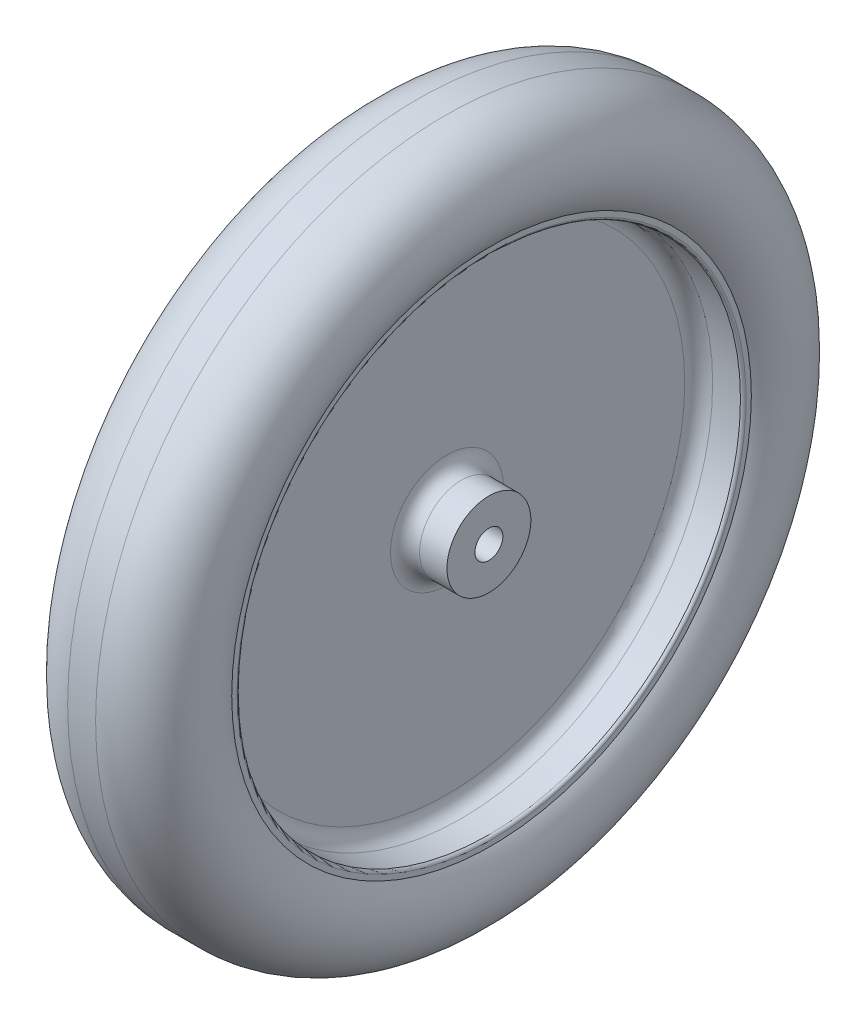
SolidWorks part; units mm, degrees
ref_plane "Plan de face" through (0, 0, 0) normal (0, 0, 1) x (1, 0, 0)
ref_plane "Plan de dessus" through (0, 0, 0) normal (0, 1, 0) x (1, 0, 0)
ref_plane "Plan de droite" through (0, 0, 0) normal (1, 0, 0) x (0, 0, -1)
sketch "Esquisse2" plane through (0, 0, 0) normal (0, 0, 1) x (1, 0, 0)
  line L0 (-36.2685, 0) -> (31.6261, 0) construction
  line L1 (-9.9547, 30) -> (-28.6438, 30)
  line L2 (31.3562, 180.0794) -> (51.2397, 180.0794)
  line L3 (1.3562, 41.3109) -> (1.3562, 170.0794)
  line L4 (0, 250) -> (20, 250)
  line L5 (21.3562, 40.4006) -> (21.3562, 170.0794)
  line L6 (51.3562, 10) -> (-28.6438, 10)
  line L7 (51.3562, 10) -> (51.3562, 30)
  line L8 (51.3562, 30) -> (31.7569, 30)
  line L9 (-28.6438, 10) -> (-28.6438, 30)
  line L10 (53.2397, 182.0794) -> (53.2397, 185.8684)
  line L11 (-8.6438, 180.0794) -> (-28.8425, 180.0794)
  line L12 (-30.8425, 182.0794) -> (-30.8425, 186.2903)
  line L13 (11.3562, 10) -> (11.3562, 264.2128) construction
  arc A0 (0, 250) -> (-30.8425, 186.2903) centre (1.3562, 210.023) ccw
  arc A1 (20, 250) -> (53.2397, 185.8684) centre (21.3562, 210.023) cw
  arc A2 (31.3562, 180.0794) -> (21.3562, 170.0794) centre (31.3562, 170.0794) ccw
  arc A3 (-8.6438, 180.0794) -> (1.3562, 170.0794) centre (-8.6438, 170.0794) cw
  arc A4 (1.3562, 41.3109) -> (-9.9547, 30) centre (-9.9547, 41.3109) cw
  arc A5 (21.3562, 40.4006) -> (31.7569, 30) centre (31.7569, 40.4006) ccw
  arc A6 (51.2397, 180.0794) -> (53.2397, 182.0794) centre (51.2397, 182.0794) ccw
  arc A7 (-28.8425, 180.0794) -> (-30.8425, 182.0794) centre (-28.8425, 182.0794) cw
  point P18 (21.3562, 180.0794)
  point P21 (1.3562, 30)
  dimension "D5" = 10
  dimension "D6" = 2
  dimension "D7" = 40
  dimension "D8" = 40
  dimension "D1" = 10
  dimension "D2" = 80
  dimension "D3" = 250
  dimension "D4" = 20
  dimension "D9" = 10
  dimension "D10" = 20
  dimension "D11" = 20
revolve "Révolution1" add sketch "Esquisse2" angle 360 about L0
